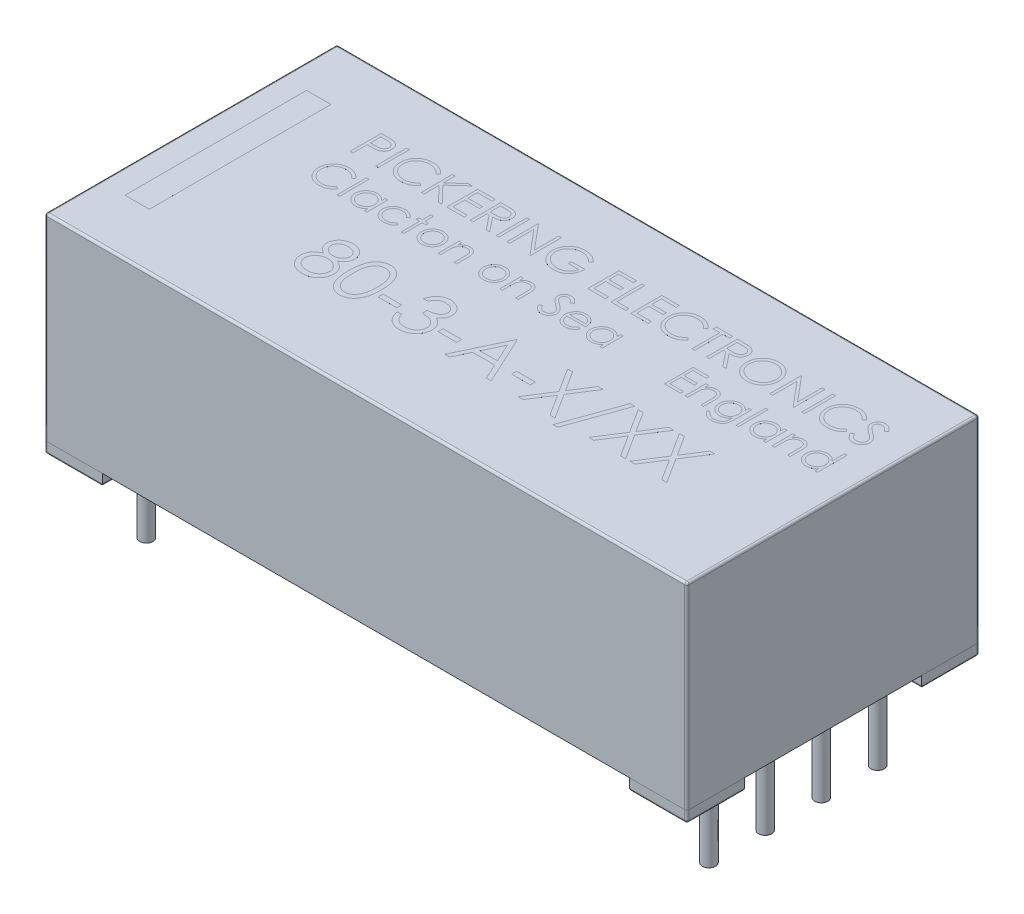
SolidWorks part; units mm, degrees
ref_plane "Front Plane" through (0, 0, 0) normal (0, 0, 1) x (1, 0, 0)
ref_plane "Top Plane" through (0, 0, 0) normal (0, 1, 0) x (1, 0, 0)
ref_plane "Right Plane" through (0, 0, 0) normal (1, 0, 0) x (0, 0, -1)
sketch "Sketch2" plane through (0, 0, 0) normal (0, 1, 0) x (1, 0, 0)
  line L1 (14.5, -6.6) -> (-14.5, -6.6)
  line L2 (14.5, -6.6) -> (14.5, 6.6)
  line L3 (14.5, 6.6) -> (-14.5, 6.6)
  line L4 (-14.5, -6.6) -> (-14.5, 6.6)
  line L5 (14.5, -6.6) -> (-14.5, 6.6) construction
  line L6 (14.5, 6.6) -> (-14.5, -6.6) construction
  point P0 (0, 0)
  dimension "D1" = 13.2
  dimension "D2" = 29
extrude "Main Body" add sketch "Sketch2" along normal blind 8.89 draft 0.023
sketch "Sketch9" plane through (0, 0, 0) normal (0, -1, 0) x (1, 0, 0)
  line L0 (14.5, -6.6) -> (-14.5, -6.6) construction
  line L1 (14.5, 6.6) -> (14.5, -6.6) construction
  circle A0 centre (12.7, -3.81) radius 0.3
  circle A1 centre (12.7, -1.27) radius 0.2963
  circle A2 centre (12.7, 1.27) radius 0.3
  circle A3 centre (12.7, 3.81) radius 0.3
  dimension "D1" = 0.6
  dimension "D5" = 0.6
  dimension "D7" = 0.6
  dimension "D2" = 2.79
  dimension "D3" = 2.54
  dimension "D4" = 1.8
  dimension "D6" = 2.54
  dimension "D8" = 2.54
extrude "Pins" add sketch "Sketch9" along normal blind 4.31
mirror "Mirror2" about plane through (0, 0, 0) normal (1, 0, 0) of "Pins"
sketch "Sketch10" plane through (0, 0, 0) normal (0, -1, 0) x (1, 0, 0)
  line L1 (14.5, 6.6) -> (11.9, 6.6)
  line L2 (14.5, 6.6) -> (14.5, 4)
  line L3 (14.5, 4) -> (11.9, 4)
  line L4 (11.9, 6.6) -> (11.9, 4)
  dimension "D1" = 2.6
  dimension "D2" = 2.6
extrude "Foot" add sketch "Sketch10" along normal blind 0.51
sketch "Sketch11" plane through (0, -0.51, 0) normal (0, -1, 0) x (1, 0, 0)
  line L0 (14.5, 6.6) -> (11.9, 6.6) construction
  line L1 (11.9, 4) -> (13.95, 4)
  line L2 (11.9, 4) -> (11.9, 6.05)
  line L3 (11.9, 6.05) -> (13.95, 6.05)
  line L4 (13.95, 4) -> (13.95, 6.05)
  line L5 (14.5, 4) -> (14.5, 6.6) construction
  dimension "D1" = 0.55
  dimension "D2" = 0.55
extrude "Extrude2" cut sketch "Sketch11" against normal up to surface (0.51 mm away)
mirror "Mirror3" about plane through (0, 0, 0) normal (0, 0, 1) of "Extrude2", "Foot"
mirror "Mirror4" about plane through (0, 0, 0) normal (1, 0, 0) of "Mirror3", "Foot", "Extrude2"
sketch "Sketch12"
  dimension "D1" = 1.1
  dimension "D2" = 8.2
  dimension "D3" = 2.4965
  dimension "D4" = 1.4
  dimension "D5" = 2
  dimension "D6" = 3.8
extrude "Lettering" add sketch "Sketch12" along normal blind 0.0001
fillet "Fillet1" radius 0.1 36 edges at (14.5, -0.255, -6.6) (-14.5, -0.255, -6.6) (14.5, -0.255, 6.6) (-14.5, -0.255, 6.6) (14.225, -0.51, -4) (14.5, -0.51, -5.3) (13.2, -0.51, -6.6) (11.9, -0.51, -6.325) (12.925, -0.51, -6.05) (13.95, -0.51, -5.025) (11.9, -0.51, 6.325) (13.2, -0.51, 6.6) (14.5, -0.51, 5.3) (14.225, -0.51, 4) (13.95, -0.51, 5.025) (12.925, -0.51, 6.05) (-11.9, -0.51, -6.325) (-13.2, -0.51, -6.6) (-14.5, -0.51, -5.3) (-14.225, -0.51, -4) (-13.95, -0.51, -5.025) (-12.925, -0.51, -6.05) (-14.225, -0.51, 4) (-14.5, -0.51, 5.3) (-13.2, -0.51, 6.6) (-11.9, -0.51, 6.325) (-12.925, -0.51, 6.05) (-13.95, -0.51, 5.025) (14.4983, 4.445, -6.5983) (-14.4983, 4.445, -6.5983) (-14.4965, 8.89, 0) (0, 8.89, -6.5965) (14.4965, 8.89, 0) (14.4983, 4.445, 6.5983) (-14.4983, 4.445, 6.5983) (0, 8.89, 6.5965)
